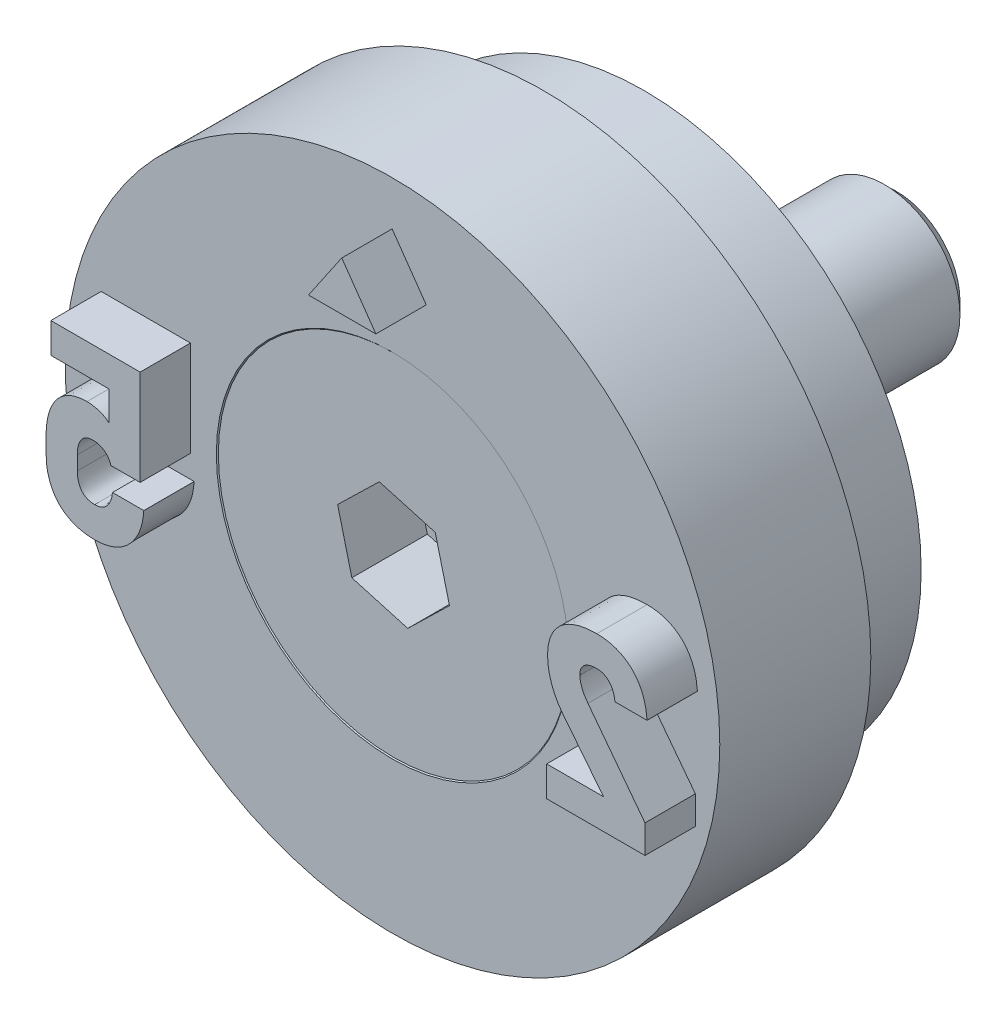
SolidWorks part; units mm, degrees
other "<M3 X .5 FHCS>-<Imported1>"
ref_plane "Front Plane" through (0, 0, 0) normal (0, 0, 1) x (1, 0, 0)
ref_plane "Top Plane" through (0, 0, 0) normal (0, 1, 0) x (1, 0, 0)
ref_plane "Right Plane" through (0, 0, 0) normal (1, 0, 0) x (0, 0, -1)
imported_body "Imported1"
other "DeleteFace1"
sketch "Sketch1" plane through (0, 0, 0) normal (0, 0, 1) x (1, 0, 0)
  line L0 (-0.0087, 5.6166) -> (-0.6694, 4.6482)
  line L1 (-0.6694, 4.6482) -> (0.6694, 4.6482)
  line L2 (0.6694, 4.6482) -> (-0.0087, 5.6166)
  text T0 "2      5" font "Bahnschrift" height 3.302
  dimension "D1" = 1.651
  dimension "D2" = 6.26
extrude "Boss-Extrude1" add sketch "Sketch1" along normal blind 1
inserted part "M3 X .5 FHCS"
move or copy body "Body-Move/Copy2" placed by mates yes
